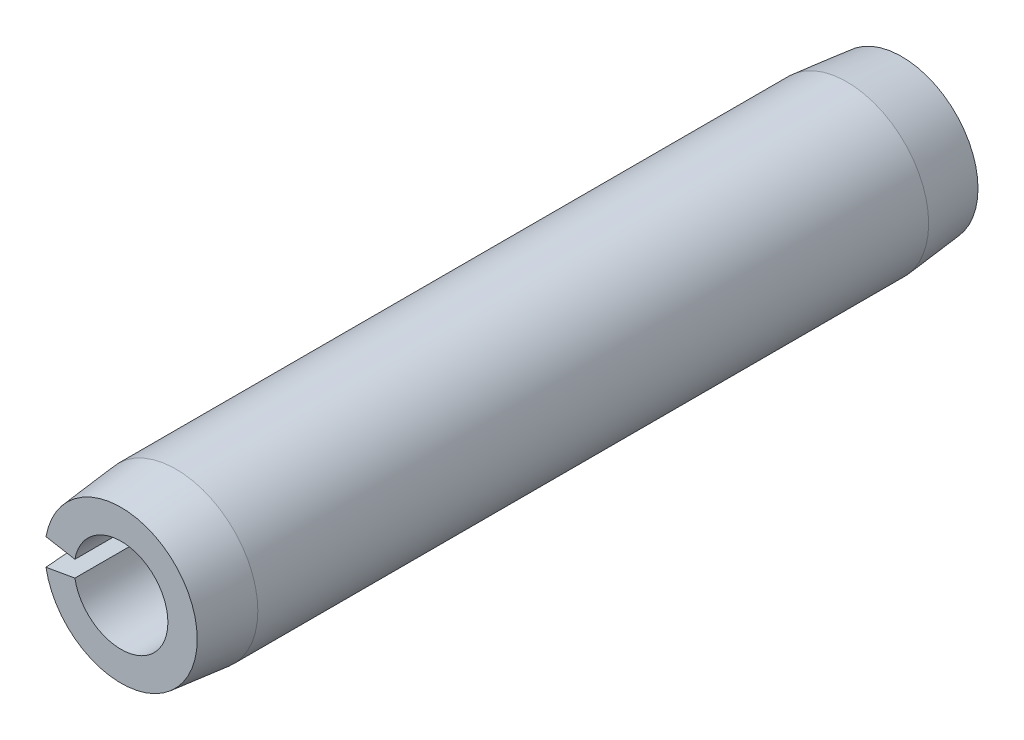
SolidWorks part; units mm, degrees
ref_plane "Front Plane" through (0, 0, 0) normal (0, 0, 1) x (1, 0, 0)
ref_plane "Top Plane" through (0, 0, 0) normal (0, 1, 0) x (1, 0, 0)
ref_plane "Right Plane" through (0, 0, 0) normal (1, 0, 0) x (0, 0, -1)
sketch "Sketch1" plane through (0, 0, 0) normal (0, 0, 1) x (1, 0, 0)
  line L0 (0.9525, 0) -> (1.6637, 0) construction
  line L1 (-1.6384, 0.2889) -> (-0.938, 0.1654)
  line L2 (-0.938, -0.1654) -> (-1.6384, -0.2889)
  arc A0 (-1.6384, -0.2889) -> (-1.6384, 0.2889) centre (0, 0) ccw
  arc A1 (-0.938, -0.1654) -> (-0.938, 0.1654) centre (0, 0) ccw
  dimension "OD" = 3.3274
  dimension "Wall thickness" = 0.7112
  dimension "D3" = 20
extrude "Extrude1" add sketch "Sketch1" along normal mid plane 15.875
sketch "Sketch2" plane through (0, 0, 0) normal (1, 0, 0) x (0, 0, -1)
  line L0 (0, -1.6637) -> (0, 1.6637) construction
  line L1 (7.9375, 0) -> (-7.9375, 0) construction
  line L2 (7.9375, -0.9525) -> (7.9375, 0.9525) construction
  line L3 (7.9375, 1.6637) -> (-7.9375, 1.6637) construction
  line L4 (7.9375, 1.6637) -> (7.9375, 1.5494)
  line L5 (7.9375, 1.5494) -> (6.8199, 1.6637)
  line L6 (6.8199, 1.6637) -> (7.9375, 1.6637)
  line L7 (7.9375, -1.6637) -> (7.9375, 1.6637) construction
  line L8 (-6.8199, 1.6637) -> (-7.9375, 1.6637)
  line L9 (-7.9375, 1.5494) -> (-6.8199, 1.6637)
  line L10 (-7.9375, 1.6637) -> (-7.9375, 1.5494)
  line L11 (6.8199, -1.6637) -> (7.9375, -1.6637) construction
  line L12 (7.9375, -1.5494) -> (6.8199, -1.6637) construction
  line L13 (7.9375, -1.6637) -> (7.9375, -1.5494) construction
  dimension "B" = 3.0988
  dimension "Chamfer max" = 1.1176
revolve "Cut-Revolve1" cut sketch "Sketch2" angle 360 about L1
sketch "Sketch3" plane through (0, 0, 0) normal (0, 0, 1) x (1, 0, 0)
  line L0 (0.9525, 0) -> (1.6637, 0) construction
  line L1 (0.9525, 0) -> (1.6637, 0)
  circle A0 centre (0, 0) radius 1.6637
  circle A1 centre (0, 0) radius 0.9525
  arc A2 (-1.6384, -0.2889) -> (-1.6384, 0.2889) centre (0, 0) ccw construction
  arc A3 (-0.938, -0.1654) -> (-0.938, 0.1654) centre (0, 0) ccw construction
